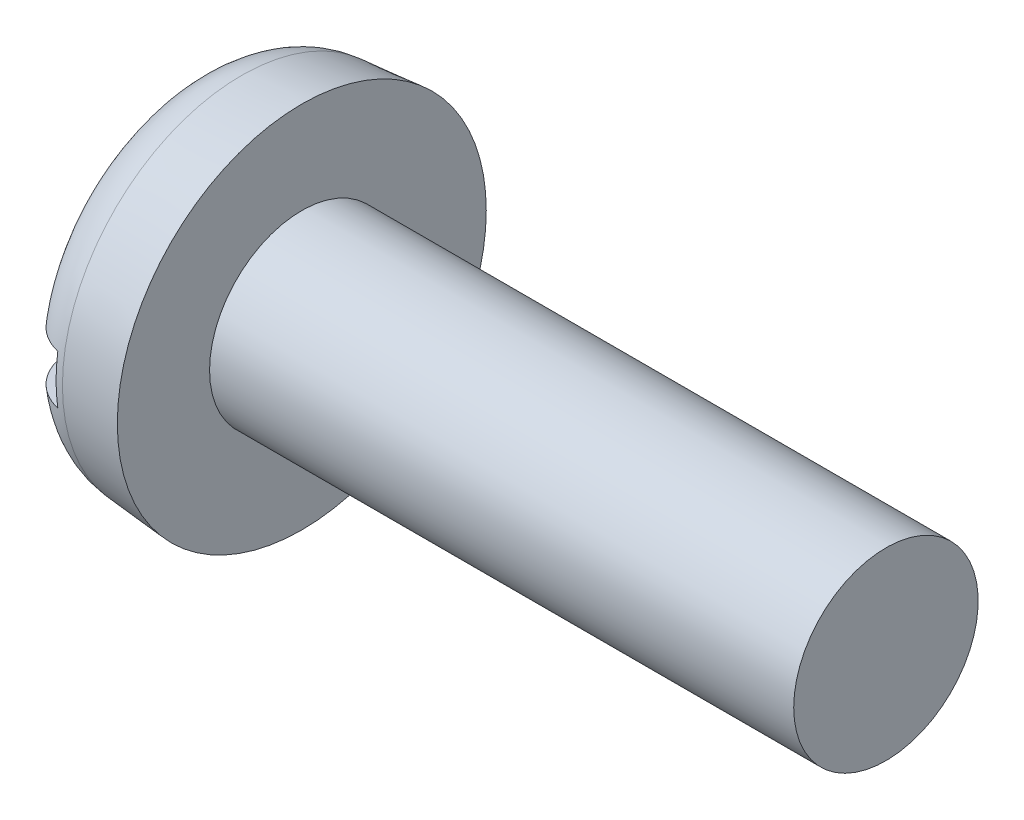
SolidWorks part; units mm, degrees
ref_plane "Plane1" through (0, 0, 0) normal (0, 0, 1) x (1, 0, 0)
ref_plane "Plane2" through (0, 0, 0) normal (0, 1, 0) x (1, 0, 0)
ref_plane "Plane3" through (0, 0, 0) normal (1, 0, 0) x (0, 0, -1)
sketch "BodySke" plane through (0, 0, 0) normal (0, 0, 1) x (1, 0, 0)
  line L0 (3.6, 3) -> (3.6, 6)
  line L1 (0, 0) -> (0, 5.685)
  line L2 (-25.4, 0) -> (127, 0) construction
  line L3 (22.6, 0) -> (0, 0)
  line L4 (3.6, 3) -> (22.6, 3)
  line L5 (22.6, 3) -> (22.6, 0)
  line L6 (0, 5.685) -> (3.6, 6)
  line L9 (4.6, 4.5875) -> (4.6, -4.9375) construction
  line L10 (3.6, 6.35) -> (3.6, -3.175) construction
  dimension "Head_ht" = 3.6
  dimension "Diameter" = 6
  dimension "Length" = 19
  dimension "Head_dia" = 12
  dimension "Advance" = 1
  dimension "Thread_nom" = 19
  dimension "Head_side_angle" = 5
revolve "Base-Revolve" add sketch "BodySke"
fillet "Fillet1" [suppressed] radius 0.25
fillet "Fillet2" radius 1.8 1 edges at (0, 0, 5.685)
sketch "Sketch2" plane through (0, 0, 0) normal (1, 0, 0) x (0, 0, -1)
  line L0 (6, -0.8) -> (-6, -0.8)
  line L1 (6, -0.8) -> (6, 0.8)
  line L2 (-6, 0.8) -> (6, 0.8)
  line L3 (-6, 0.8) -> (-6, -0.8)
  dimension "D1" = 12
  dimension "D2" = 6
  dimension "Slot_width" = 1.6
  dimension "D3" = 0.8
extrude "Slot" cut sketch "Sketch2" along normal blind 1.4
sketch "ThdSchSke" plane through (0, 0, 0) normal (0, 0, 1) x (1, 0, 0)
  line L0 (5.6, -2.4455) -> (5.2117, -3)
  line L1 (5.6, -2.4455) -> (5.9883, -3)
  line L2 (5.9883, -3) -> (5.9883, -3.75)
  line L3 (-3.175, 0) -> (5.1513, 0) construction
  line L5 (5.9883, -3.75) -> (5.2117, -3.75)
  line L6 (5.2117, -3.75) -> (5.2117, -3)
  dimension "Thread_minor" = 4.891
  dimension "Diameter" = 6
  dimension "Start" = 5.6
  dimension "SideAngle" = 55
  dimension "VeeAngle" = 70
  dimension "Overcut" = 7.5
revolve "ThreadSchematic" [suppressed] cut sketch "ThdSchSke" angle 360 about L3
pattern_linear "ThdSchPat" [suppressed]
equation "\"D1@Sketch2\" = \"Head_dia@BodySke\""
equation "\"D2@Sketch2\" = \"D1@Sketch2\" / 2"
equation "\"D3@Sketch2\" = \"Slot_width@Sketch2\" / 2"
equation "\"Thread_length@ThreadCosmetic\" = ((sgn( (\"Length@BodySke\" - \"Advance@BodySke\" * 2.0 ) - \"Thread_nom@BodySke\" )-1)*( (\"Length@BodySke\" - \"Advance@BodySke\"  * 2.0) - \"Thread_nom@BodySke\" ))/-2+ \"Thread_"
equation "\"Thread_minor@ThdSchSke\" = \"Thread_minor@ThreadCosmetic\""
equation "\"Diameter@ThdSchSke\" = \"Diameter@BodySke\""
equation "\"Overcut@ThdSchSke\" = \"Diameter@BodySke\" * 1.25"
equation "\"Start@ThdSchSke\" = \"Head_ht@BodySke\" + \"Length@BodySke\" - \"Thread_length@ThreadCosmetic\"  '---Non-countersunk---"
equation "\"Num_threads@ThdSchPat\" = int( \"Thread_length@ThreadCosmetic\" / \"Advance@BodySke\" + 0.999 )  + 1"
equation "\"Advance@ThdSchPat\" = \"Thread_length@ThreadCosmetic\" /  (\"Num_threads@ThdSchPat\" - 1) 'relax it"
